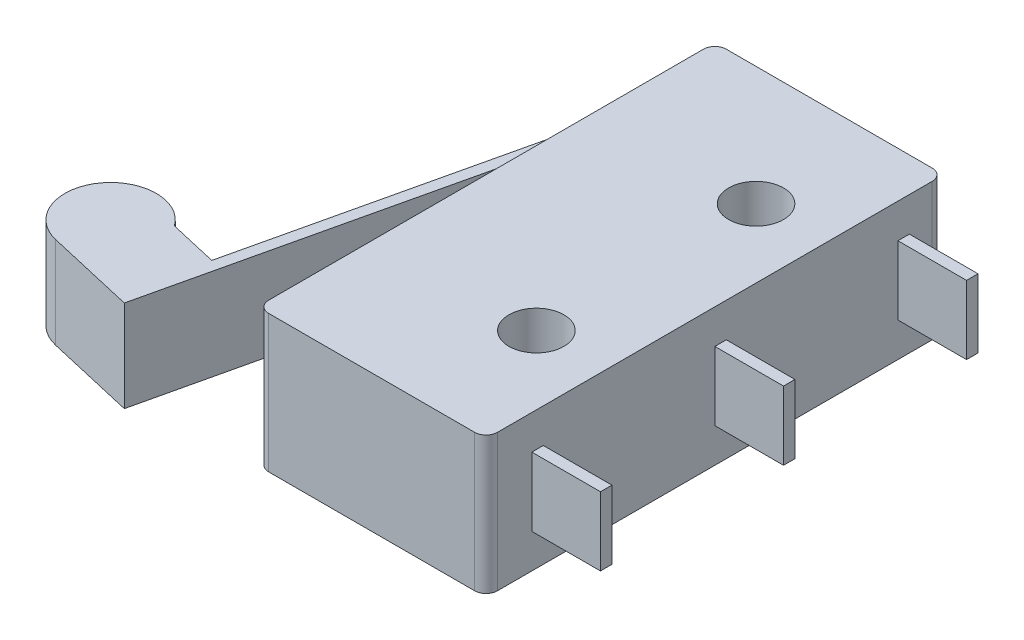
SolidWorks part; units mm, degrees
ref_plane "Front Plane" through (0, 0, 0) normal (0, 0, 1) x (1, 0, 0)
ref_plane "Top Plane" through (0, 0, 0) normal (0, 1, 0) x (1, 0, 0)
ref_plane "Right Plane" through (0, 0, 0) normal (1, 0, 0) x (0, 0, -1)
sketch "Esquisse1" plane through (0, 0, 0) normal (0, 1, 0) x (1, 0, 0)
  line L1 (-5, -10) -> (5, -10)
  line L2 (-5, -10) -> (-5, 10)
  line L3 (-5, 10) -> (5, 10)
  line L4 (5, -10) -> (5, 10)
  line L5 (-5, -10) -> (5, 10) construction
  line L6 (-5, 10) -> (5, -10) construction
  circle A0 centre (2, 4.8) radius 1.2
  circle A1 centre (2, -4.8) radius 1.2
  point P0 (0, 0)
other "Esquisse au crayon1" parameters "D3"=8.7314, "D4"=8.7314, "D5"=8.7314, "D6"=8.7314, "D7"=3, "D1"=49.83, "D2"=24.8193
extrude "Boss.-Extru.1" add sketch "Esquisse1" along normal mid plane 6
sketch "Esquisse2" plane through (0, 0, 0) normal (0, 1, 0) x (1, 0, 0)
  line L0 (-5, 8) -> (-8.749, -8.2386)
  line L1 (-5, 10) -> (-5, -10) construction
  line L3 (-9.0491, -11.7614) -> (-5, 5.7773)
  line L4 (-5, 5.7773) -> (-5, 8)
  line L5 (5, 10) -> (-5, 10) construction
  line L6 (-8.749, -8.2386) -> (-10.8703, -7.7488)
  line L7 (-9.0491, -11.7614) -> (-12.9466, -10.8616)
  arc A1 (-10.8703, -7.7488) -> (-12.9466, -10.8616) centre (-12.4967, -8.9128) ccw
  dimension "D1" = 2
  dimension "D3" = 13
  dimension "D4" = 3.5
  dimension "D7" = 2
  dimension "D2" = 0.5
  dimension "D5" = 4
  dimension "D6" = 18
extrude "Boss.-Extru.2" add sketch "Esquisse2" along normal mid plane 4
fillet "Congé1" radius 0.5 4 edges at (-5, 0, -10) (5, 0, -10) (5, 0, 10) (-5, 0, 10)
sketch "Esquisse3" plane through (0, 0, 0) normal (0, 1, 0) x (1, 0, 0)
  line L0 (5, -9.5) -> (5, 9.5) construction
  line L1 (5, 8.5) -> (8, 8.5)
  line L2 (5, 8.5) -> (5, 8)
  line L3 (5, 8) -> (8, 8)
  line L4 (8, 8.5) -> (8, 8)
  line L5 (4.5, 10) -> (-4.5, 10) construction
  dimension "D1" = 1.5
  dimension "D2" = 3
  dimension "D3" = 0.5
extrude "Boss.-Extru.3" add sketch "Esquisse3" along normal mid plane 3
pattern_linear "Répétition linéaire1" count 3 spacing 8 along (0, 0, 1) of "Boss.-Extru.3"
